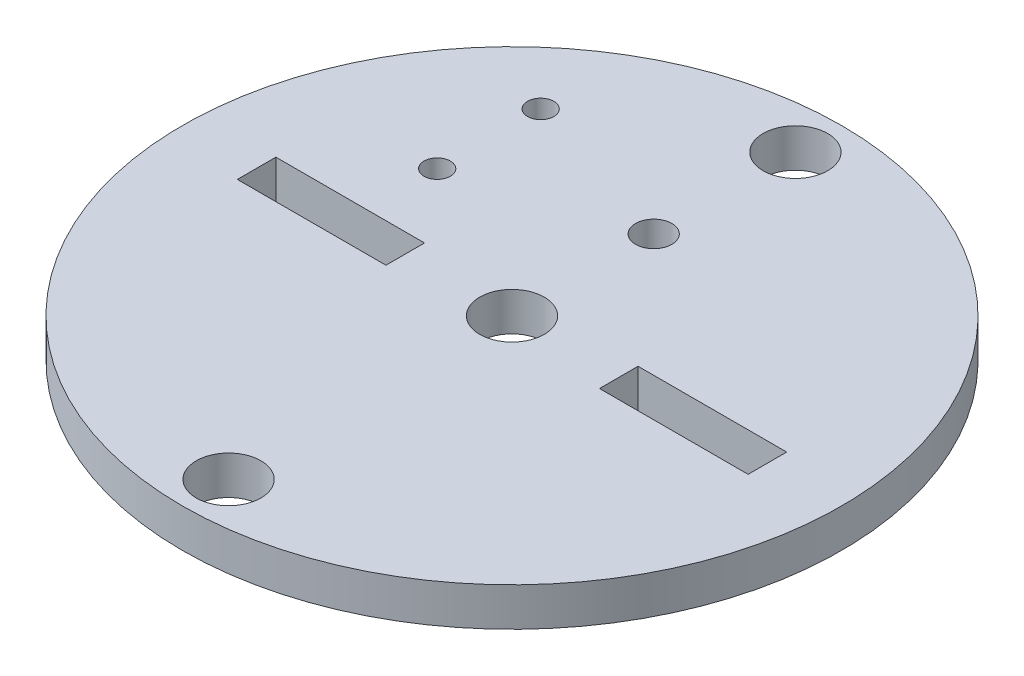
SolidWorks part; units mm, degrees
ref_plane "Front Plane" through (0, 0, 0) normal (0, 0, 1) x (1, 0, 0)
ref_plane "Top Plane" through (0, 0, 0) normal (0, 1, 0) x (1, 0, 0)
ref_plane "Right Plane" through (0, 0, 0) normal (1, 0, 0) x (0, 0, -1)
sketch "Sketch1" plane through (0, 0, 0) normal (0, 1, 0) x (1, 0, 0)
  circle A0 centre (0, 0) radius 25.4
  dimension "D1" = 50.8
extrude "Boss-Extrude1" add sketch "Sketch1" along normal blind 2.9718
hole_wizard "#10 Clearance Hole1" positions "Sketch3" profile "Sketch4" hole size "#10" standard "ANSI Inch"
sketch "Sketch3" plane through (0, 2.9718, 0) normal (0, 1, 0) x (1, 0, 0)
  line L0 (-25.4, 0) -> (25.4, 0) construction
  line L2 (0, 25.4) -> (0, -25.4) construction
  circle A0 centre (0, 0) radius 25.4 construction
  point P0 (0, 0)
  point P28 (0, 21.844)
  point P29 (0, -21.844)
  dimension "D1" = 21.844
sketch "Sketch4" plane through (0, 2.9718, 0) normal (1, 0, 0) x (0, 0, 1)
  line L0 (0, 0) -> (0, 2.9718)
  line L1 (0, 2.9718) -> (2.4892, 2.9718)
  line L2 (2.4892, 2.9718) -> (2.4892, 0)
  line L5 (2.4892, 0) -> (0, 0)
  line L11 (0, -6.35) -> (0, 107.95) construction
  dimension "Thru Hole Dia." = 4.9784
  dimension "Thru Hole Depth" = 2.9718
sketch "Sketch5" plane through (0, 2.9718, 0) normal (0, 1, 0) x (1, 0, 0)
  line L0 (0, -25.4) -> (0, 25.4) construction
  line L1 (-25.4, 0) -> (25.4, 0) construction
  line L2 (-8.2296, -1.4859) -> (-19.685, 1.4859) construction
  line L3 (8.2296, 1.4859) -> (19.685, 1.4859)
  line L4 (8.2296, 1.4859) -> (8.2296, -1.4859)
  line L5 (8.2296, -1.4859) -> (19.685, -1.4859)
  line L6 (19.685, 1.4859) -> (19.685, -1.4859)
  line L7 (8.2296, 1.4859) -> (19.685, -1.4859) construction
  line L8 (8.2296, -1.4859) -> (19.685, 1.4859) construction
  line L9 (-8.2296, 1.4859) -> (-19.685, -1.4859) construction
  line L10 (-19.685, 1.4859) -> (-19.685, -1.4859)
  line L11 (-8.2296, -1.4859) -> (-19.685, -1.4859)
  line L12 (-8.2296, 1.4859) -> (-8.2296, -1.4859)
  line L13 (-8.2296, 1.4859) -> (-19.685, 1.4859)
  circle A0 centre (0, 0) radius 25.4 construction
  point P7 (13.9573, 0)
  point P17 (-13.9573, 0)
extrude "Cut-Extrude1" cut sketch "Sketch5" against normal through all
sketch "Sketch6" plane through (0, 2.9718, 0) normal (0, 1, 0) x (1, 0, 0)
  line L0 (0, -25.4) -> (0, 25.4) construction
  line L1 (-25.4, 0) -> (25.4, 0) construction
  line L2 (0, 10.922) -> (-19.68, 10.922) construction
  line L3 (-12.7, 18.7691) -> (-12.7, 3.2999) construction
  circle A0 centre (0, 0) radius 25.4 construction
  circle A1 centre (0, 10.922) radius 1.397
  circle A2 centre (-12.7, 14.9098) radius 1.016
  circle A3 centre (-12.7, 6.9342) radius 1.016
  dimension "D1" = 10.922
  dimension "D2" = 2.794
  dimension "D4" = 3.9878
  dimension "D5" = 2.032
  dimension "D3" = 12.7
extrude "Cut-Extrude2" cut sketch "Sketch6" against normal through all
sketch "Sketch8" plane through (0, 2.9718, 0) normal (0, 1, 0) x (1, 0, 0)
  line L8 (-8.3312, -1.3843) -> (-8.3312, 1.3843)
  line L9 (-19.5834, -1.3843) -> (-8.3312, -1.3843)
  line L10 (-19.5834, 1.3843) -> (-19.5834, -1.3843)
  line L11 (-8.3312, 1.3843) -> (-19.5834, 1.3843)
  line L12 (-8.3312, -1.3843) -> (-8.3312, 1.3843)
  line L13 (-19.5834, -1.3843) -> (-8.3312, -1.3843)
  line L14 (-19.5834, 1.3843) -> (-19.5834, -1.3843)
  line L15 (-8.3312, 1.3843) -> (-19.5834, 1.3843)
  line L20 (8.3312, 1.3843) -> (8.3312, -1.3843)
  line L21 (19.5834, 1.3843) -> (8.3312, 1.3843)
  line L22 (19.5834, -1.3843) -> (19.5834, 1.3843)
  line L23 (8.3312, -1.3843) -> (19.5834, -1.3843)
  line L24 (8.3312, 1.3843) -> (8.3312, -1.3843)
  line L25 (19.5834, 1.3843) -> (8.3312, 1.3843)
  line L26 (19.5834, -1.3843) -> (19.5834, 1.3843)
  line L27 (8.3312, -1.3843) -> (19.5834, -1.3843)
  circle A2 centre (0, 0) radius 25.5016
  circle A3 centre (0, 0) radius 25.5016
  circle A5 centre (0, 21.844) radius 2.3876
  circle A6 centre (0, 21.844) radius 2.3876
  circle A8 centre (-12.7, 14.9098) radius 0.9144
  circle A9 centre (-12.7, 14.9098) radius 0.9144
  circle A11 centre (0, 10.922) radius 1.2954
  circle A12 centre (0, 10.922) radius 1.2954
  circle A14 centre (-12.7, 6.9342) radius 0.9144
  circle A15 centre (-12.7, 6.9342) radius 0.9144
  circle A17 centre (0, 0) radius 2.3876
  circle A18 centre (0, 0) radius 2.3876
  circle A20 centre (0, -21.844) radius 2.3876
  circle A21 centre (0, -21.844) radius 2.3876
equation "\"t\"= .117in'plywood thickness"
equation "\"kerf\"= .004in'laser cutter kerf"
equation "\"D1@Boss-Extrude1\"=\"t\""
equation "\"D3@Sketch5\"=\"t\""
equation "\"D1@Sketch8\"=\"kerf\""
equation "\"D2@Sketch8\"=\"kerf\""
equation "\"D3@Sketch8\"=\"kerf\""
equation "\"D4@Sketch8\"=\"kerf\""
equation "\"D5@Sketch8\"=\"kerf\""
equation "\"D6@Sketch8\"=\"kerf\""
equation "\"D7@Sketch8\"=\"kerf\""
equation "\"D8@Sketch8\"=\"kerf\""
equation "\"D9@Sketch8\"=\"kerf\""
